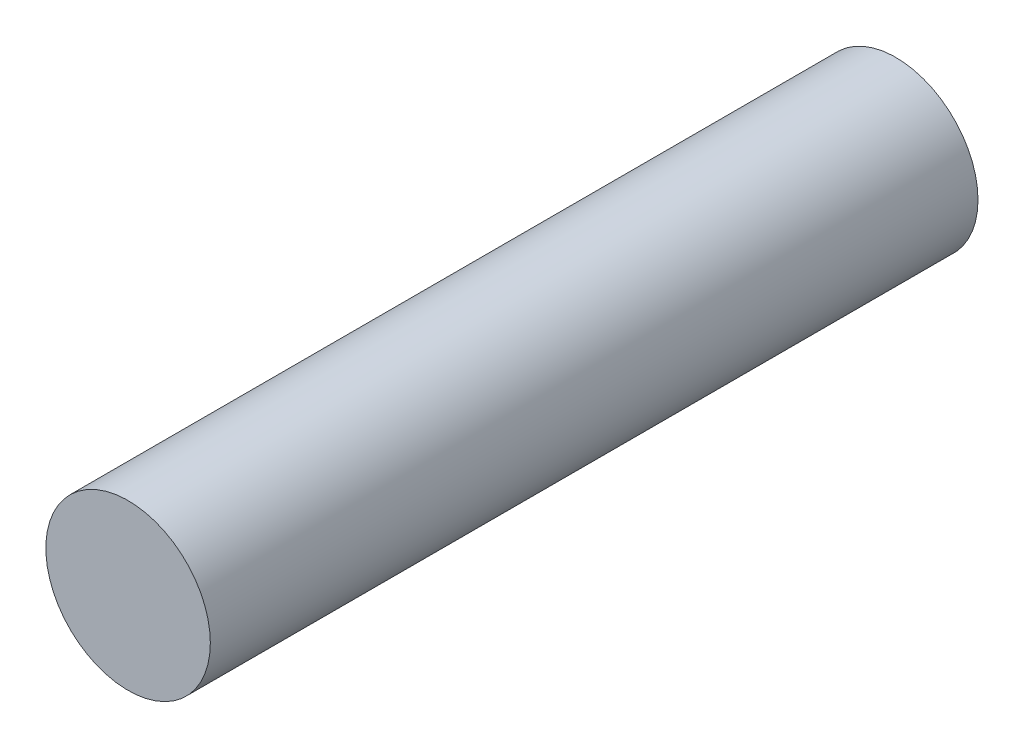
SolidWorks part; units mm, degrees
ref_plane "Front Plane" through (0, 0, 0) normal (0, 0, 1) x (1, 0, 0)
ref_plane "Top Plane" through (0, 0, 0) normal (0, 1, 0) x (1, 0, 0)
ref_plane "Right Plane" through (0, 0, 0) normal (1, 0, 0) x (0, 0, -1)
sketch "Sketch1" plane through (0, 0, 0) normal (0, 0, 1) x (1, 0, 0)
  circle A0 centre (0, 0) radius 1.5
extrude "Boss-Extrude1" add sketch "Sketch1" along normal blind 14
